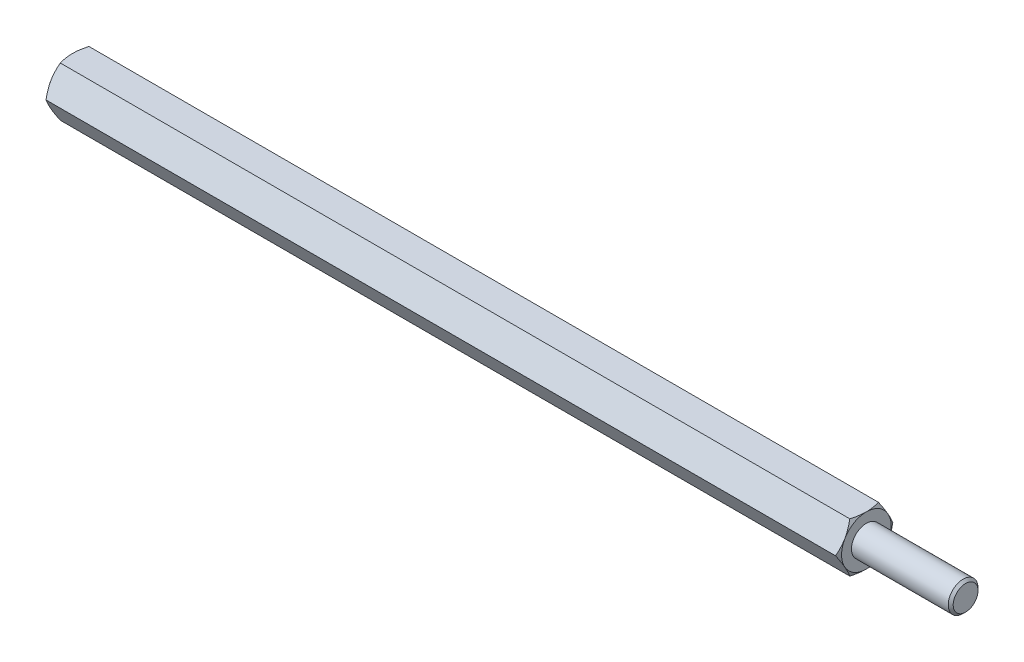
SolidWorks part; units mm, degrees
ref_plane "Front Plane" through (0, 0, 0) normal (0, 0, 1) x (1, 0, 0)
ref_plane "Top Plane" through (0, 0, 0) normal (0, 1, 0) x (1, 0, 0)
ref_plane "Right Plane" through (0, 0, 0) normal (1, 0, 0) x (0, 0, -1)
sketch "Sketch1" plane through (0, 0, 0) normal (1, 0, 0) x (0, 0, -1)
  line L1 (1.4434, 2.5) -> (-1.4434, 2.5)
  line L2 (-1.4434, 2.5) -> (-2.8868, 0)
  line L3 (-2.8868, 0) -> (-1.4434, -2.5)
  line L4 (-1.4434, -2.5) -> (1.4434, -2.5)
  line L5 (1.4434, -2.5) -> (2.8868, 0)
  line L6 (2.8868, 0) -> (1.4434, 2.5)
  circle A0 centre (0, 0) radius 2.5 construction
  dimension "D1" = 5
extrude "Extrude2" add sketch "Sketch1" along normal mid plane 80
sketch "Sketch2" plane through (0, 0, 0) normal (0, 0, 1) x (1, 0, 0)
  line L0 (-40, 2.5) -> (-38.5, 5.0981)
  line L1 (-40, 5.5) -> (-40, 2.5)
  line L3 (0, 0) -> (50000, 0) construction
  arc A0 (-38.5, 5.0981) -> (-40, 5.5) centre (-39.1962, 5.5) ccw
  dimension "D1" = 30
  dimension "D2" = 3
revolve "Cut-Revolve1" cut sketch "Sketch2" angle 360 about L3
mirror "Mirror1" about plane through (0, 0, 0) normal (1, 0, 0) of "Cut-Revolve1"
sketch "Sketch3" plane through (-40, 0, 0) normal (-1, 0, 0) x (0, 0, 1)
  circle A0 centre (0, 0) radius 1.25
  dimension "D1" = 2.5
extrude "Extrude3" cut sketch "Sketch3" against normal blind 10
sketch "Sketch4" plane through (0, 0, 0) normal (0, 0, 1) x (1, 0, 0)
  line L0 (-30, 0) -> (-30, 1.25)
  line L1 (39.7767, 0) -> (-39.7767, 0) construction
  line L2 (-30, 1.25) -> (-29.2783, 0)
  line L3 (-29.2783, 0) -> (-30, 0)
  line L4 (-40, 1.25) -> (-40, -1.25) construction
  point P4 (-40, 0)
  dimension "D1" = 30
  dimension "D2" = 1.25
  dimension "D3" = 10
revolve "Cut-Revolve2" cut sketch "Sketch4" angle 360 about L3
sketch "Sketch5" plane through (40, 0, 0) normal (1, 0, 0) x (0, 0, -1)
  circle A0 centre (0, 0) radius 1.5
  dimension "D1" = 3
extrude "Extrude4" add sketch "Sketch5" along normal blind 10
chamfer "Chamfer1" distance 0.25 angle 45 1 edges at (50, 0, -1.5)
equation "\"D2@Sketch4\" = \"D1@Sketch3\"/2"
